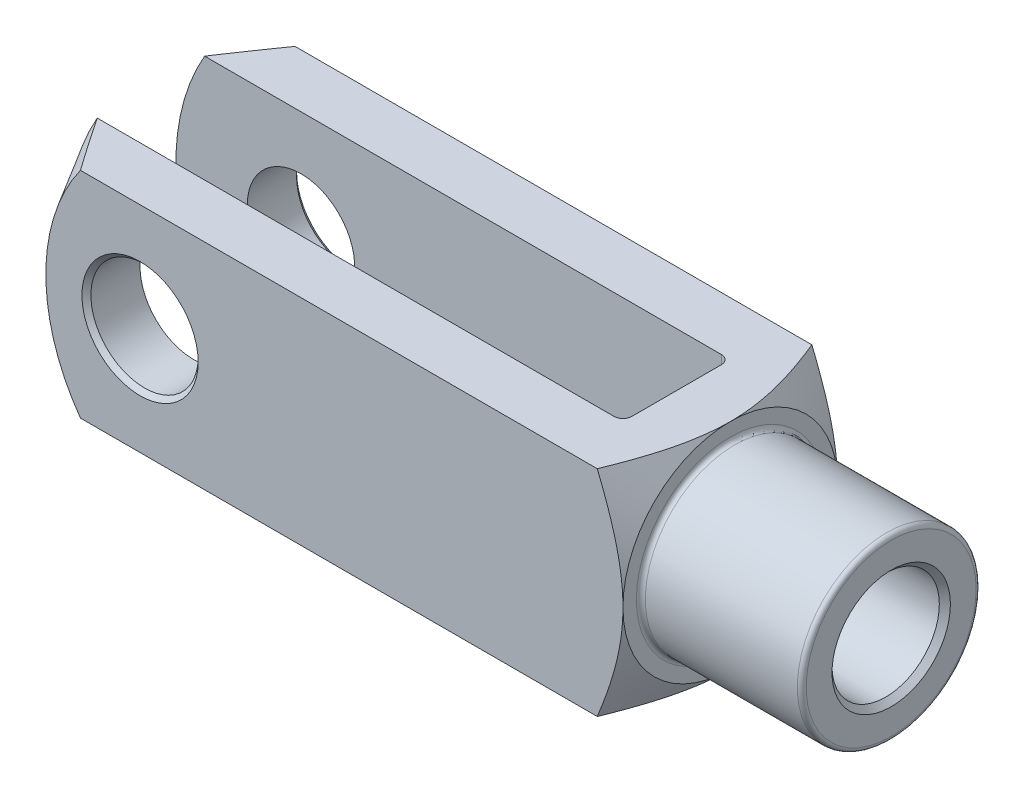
SolidWorks part; units mm, degrees
ref_plane "Front Plane" through (0, 0, 0) normal (0, 0, 1) x (1, 0, 0)
ref_plane "Top Plane" through (0, 0, 0) normal (0, 1, 0) x (1, 0, 0)
ref_plane "Right Plane" through (0, 0, 0) normal (1, 0, 0) x (0, 0, -1)
sketch "Sketch1" plane through (0, 0, 0) normal (1, 0, 0) x (0, 0, -1)
  line L0 (0, 0) -> (0, 50000) construction
  line L1 (0, 0) -> (50000, 0) construction
  line L2 (-12, -12) -> (-12, 12)
  line L3 (-12, 12) -> (12, 12)
  line L4 (12, -12) -> (12, 12)
  line L5 (-12, -12) -> (12, -12)
  point P9 (0, 12)
  point P11 (12, 0)
  point P12 (-12, 0)
  dimension "D1" = 24
  dimension "D2" = 24
extrude "Extrude1" add sketch "Sketch1" against normal blind 86
sketch "Sketch2" plane through (0, 0, 0) normal (1, 0, 0) x (0, 0, -1)
  circle A0 centre (0, 0) radius 10
  circle A1 centre (0, 0) radius 20
  dimension "D1" = 20
  dimension "D2" = 40
extrude "Extrude2" cut sketch "Sketch2" against normal blind 18
sketch "Sketch3" plane through (0, 0, 12) normal (0, 0, 1) x (1, 0, 0)
  circle A0 centre (-72, 0) radius 6
  dimension "D1" = 12
  dimension "D2" = 72
extrude "Extrude3" cut sketch "Sketch3" against normal through all
sketch "Sketch4" plane through (0, 12, 0) normal (0, 1, 0) x (1, 0, 0)
  line L0 (0, 0) -> (-50000, 0) construction
  line L1 (-86, -6) -> (-86, 6)
  line L2 (-86, 12) -> (-86, -12) construction
  line L3 (-86, 6) -> (-24, 6)
  line L4 (-24, 6) -> (-24, -6)
  line L5 (-72, 12) -> (-72, -12) construction
  line L6 (-86, -6) -> (-24, -6)
  point P7 (-72, 0)
  point P13 (-24, 0)
  point P14 (-86, 0)
  dimension "D1" = 48
  dimension "D2" = 12
extrude "Extrude4" cut sketch "Sketch4" against normal through all
fillet "Fillet1" radius 1 2 edges at (-24, 0, 6) (-24, 0, -6)
fillet "Fillet2" radius 0.5 2 edges at (0, 0, -10) (-18, 0, -10)
chamfer "Chamfer2" distance 0.5 angle 45 2 edges at (-66, 0, -12) (-66, 0, 12)
sketch "Sketch6" plane through (0, 0, 0) normal (0, 0, 1) x (1, 0, 0)
  line L0 (-18, -12) -> (-18, -24)
  line L1 (-18, -24) -> (-24.9282, -24)
  line L2 (-24.9282, -24) -> (-18, -12)
  dimension "D1" = 30
  dimension "D2" = 24
revolve "Cut-Revolve1" cut sketch "Sketch6" angle 360 about axis through (-18, 0, 0) along (1, 0, 0)
sketch "Sketch7" plane through (0, 0, 0) normal (0, 1, 0) x (1, 0, 0)
  line L0 (-82.5359, -12) -> (-86, -6)
  line L1 (-86, 6) -> (-82.5359, 12)
  line L2 (-82.5359, 12) -> (-110, 12)
  line L3 (-86, 6) -> (-86, -6)
  line L4 (-110, 12) -> (-110, -12)
  line L5 (-110, -12) -> (-82.5359, -12)
  line L6 (-86, 12) -> (-20.8698, 12) construction
  line L7 (-86, -12) -> (-20.8698, -12) construction
  line L8 (-62, 0.6162) -> (-62, 50000.6162) construction
  dimension "D1" = 120
  dimension "D2" = 24
  dimension "D3" = 24
revolve "Cut-Revolve2" cut sketch "Sketch7" angle 180 about L8
sketch "Sketch8" plane through (0, 0, 0) normal (1, 0, 0) x (0, 0, -1)
  circle A0 centre (0, 0) radius 6
  dimension "D1" = 12
extrude "Extrude5" cut sketch "Sketch8" against normal through all
chamfer "Chamfer3" distance 0.62 angle 45 1 edges at (0, 0, -6)
equation "\"D2@Sketch1\" = \"D1@Sketch1\""
equation "\"D2@Sketch2\" = \"D1@Sketch2\"*2"
equation "\"D2@Sketch6\" = \"D1@Sketch1\""
equation "\"D2@Sketch7\" = \"D1@Sketch1\""
equation "\"D3@Sketch7\" = \"D1@Sketch1\""
